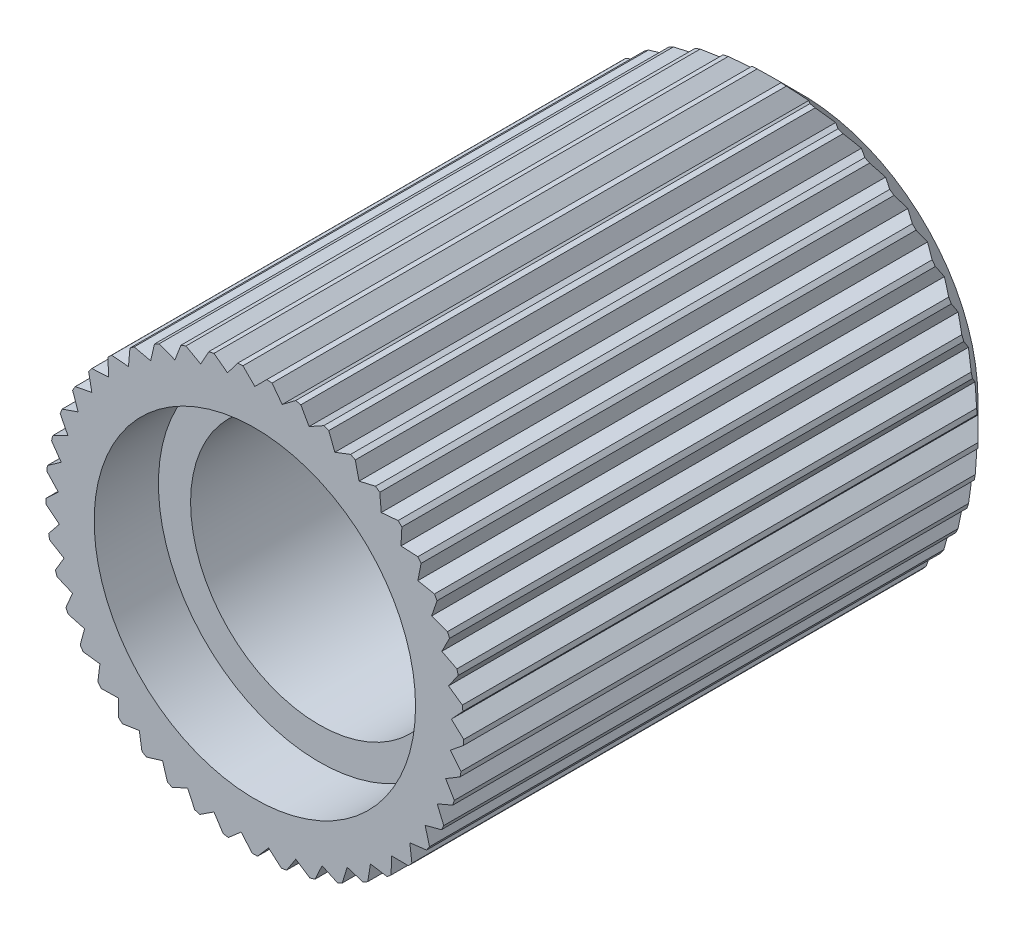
SolidWorks part; units mm, degrees
ref_plane "Plan de face" through (0, 0, 0) normal (0, 0, 1) x (1, 0, 0)
ref_plane "Plan de dessus" through (0, 0, 0) normal (0, 1, 0) x (1, 0, 0)
ref_plane "Plan de droite" through (0, 0, 0) normal (1, 0, 0) x (0, 0, -1)
sketch "Esquisse1" plane through (0, 0, 0) normal (0, 0, 1) x (1, 0, 0)
  circle A0 centre (0, 0) radius 6.5
  circle A1 centre (0, 0) radius 4
  dimension "D1" = 13
  dimension "D2" = 8
extrude "Extrusion1" add sketch "Esquisse1" along normal blind 17
sketch "Esquisse2" plane through (0, 0, 0) normal (0, 0, -1) x (-1, 0, 0)
  circle A0 centre (0, 0) radius 5
  dimension "D1" = 10
extrude "Enlèv. mat.-Extru.1" cut sketch "Esquisse2" against normal blind 3
sketch "Esquisse3" plane through (0, 0, 17) normal (0, 0, 1) x (1, 0, 0)
  circle A0 centre (0, 0) radius 5
  dimension "D1" = 10
extrude "Enlèv. mat.-Extru.2" cut sketch "Esquisse3" against normal blind 2
chamfer "Chanfrein1" distance 1 angle 45 1 edges at (6.5, 0, 0)
sketch "Esquisse4" plane through (0, 0, 17) normal (0, 0, 1) x (1, 0, 0)
  line L0 (-0.3715, 6.4894) -> (0, 6.1179)
  line L1 (0, 6.1179) -> (0.3715, 6.4894)
  circle A0 centre (0, 0) radius 6.5 construction
extrude "Enlèv. mat.-Extru.3" cut sketch "Esquisse4" against normal through all and the other way through all
pattern_circular "Répétition circulaire1" count 45 over 360 about axis through (0, 0, 17) along (0, 0, -1) of "Enlèv. mat.-Extru.3"
